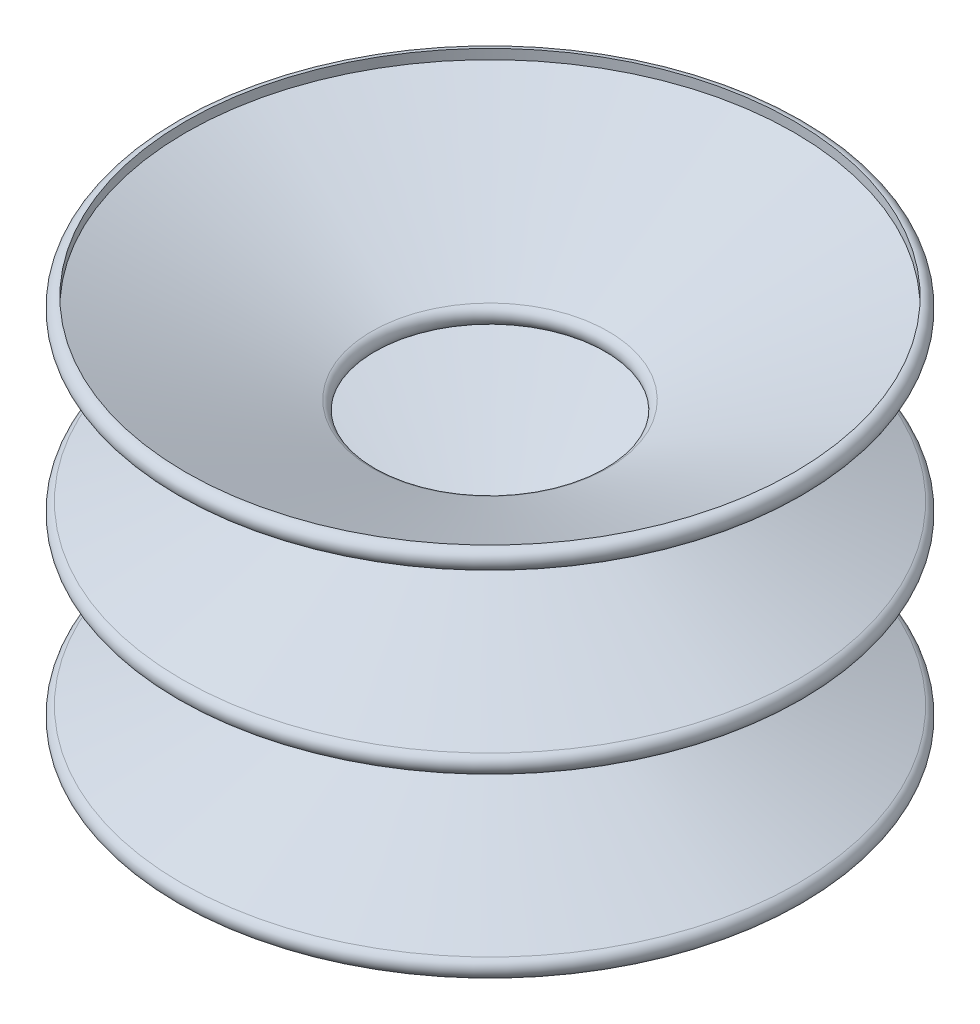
SolidWorks part; units mm, degrees
ref_plane "Face" through (0, 0, 0) normal (0, 0, 1) x (1, 0, 0)
ref_plane "Dessus" through (0, 0, 0) normal (0, 1, 0) x (1, 0, 0)
ref_plane "Droite" through (0, 0, 0) normal (1, 0, 0) x (0, 0, -1)
sketch "Esquisse1" plane through (0, 0, 0) normal (0, 0, 1) x (1, 0, 0)
  line L0 (0, 90.871) -> (0, -116.1339) construction
  line L1 (-5, 0) -> (-10, 0)
  line L2 (-10, 0) -> (-10, 4)
  line L3 (-10, 4) -> (-31.3533, 12.0645)
  line L4 (-31.3924, 13.9198) -> (-14.6074, 21.0797)
  line L5 (-31.3924, 30.0802) -> (-14.6074, 22.9203)
  line L11 (-31.3924, 31.9198) -> (-14.6076, 39.0802)
  line L12 (-14.6076, 40.9198) -> (-31.3924, 48.0802)
  line L13 (-31, 49) -> (-31, 50)
  line L14 (-9, 1) -> (-5, 1)
  line L15 (-5, 1) -> (-5, 0)
  line L19 (-31, 49) -> (-12.0576, 40.9198)
  line L20 (-12.0576, 39.0802) -> (-31, 31)
  line L21 (-31, 31) -> (-12.0576, 22.9198)
  line L22 (-9, 1) -> (-9, 4.69)
  line L23 (-12.0576, 21.0802) -> (-31, 13)
  line L24 (-31, 13) -> (-9, 4.69)
  arc A0 (-31, 50) -> (-31.3924, 48.0802) centre (-31, 49) ccw
  arc A1 (-14.6076, 39.0802) -> (-14.6076, 40.9198) centre (-15, 40) ccw
  arc A2 (-12.0576, 39.0802) -> (-12.0576, 40.9198) centre (-12.45, 40) ccw
  arc A3 (-31.3924, 31.9198) -> (-31.3924, 30.0802) centre (-31, 31) ccw
  arc A4 (-12.0576, 21.0802) -> (-12.0576, 22.9198) centre (-12.45, 22) ccw
  arc A5 (-14.6074, 21.0797) -> (-14.6074, 22.9203) centre (-15, 22) ccw
  arc A6 (-31.3924, 13.9198) -> (-31.3533, 12.0645) centre (-31, 13) ccw
  dimension "D13" = 2
  dimension "D14" = 2
  dimension "D15" = 2
  dimension "D16" = 2
  dimension "D17" = 2
  dimension "D19" = 2
  dimension "D7" = 1.0005
  dimension "D3" = 5
  dimension "D4" = 10
  dimension "D5" = 4
  dimension "D6" = 1
  dimension "D20" = 3.69
  dimension "D21" = 1
revolve "Base-Révolution" add sketch "Esquisse1" angle 360 about L0
